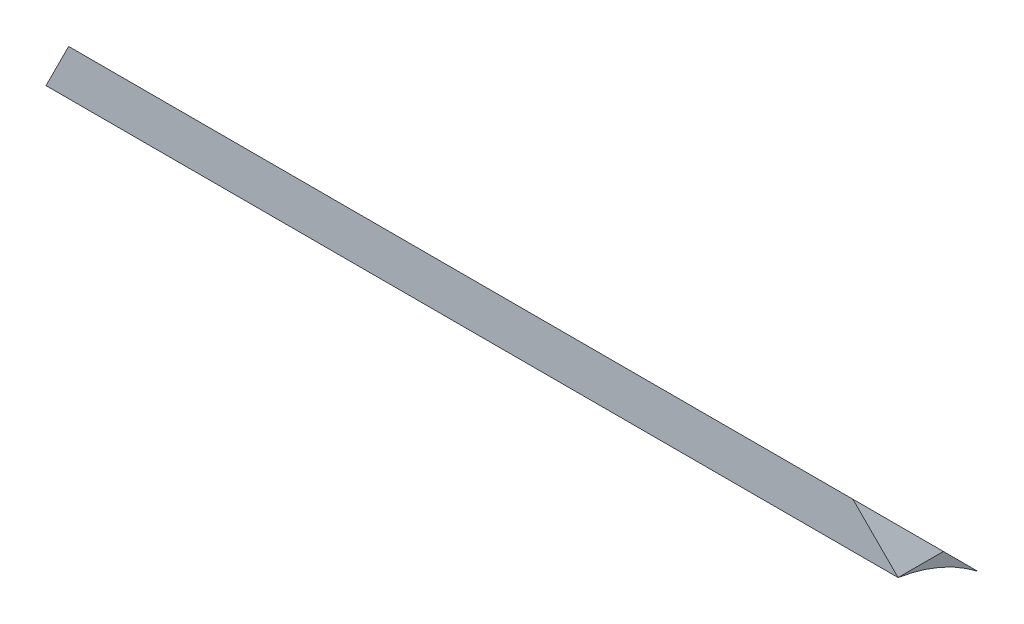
SolidWorks part; units mm, degrees
ref_plane "Front Plane" through (0, 0, 0) normal (0, 0, 1) x (1, 0, 0)
ref_plane "Top Plane" through (0, 0, 0) normal (0, 1, 0) x (1, 0, 0)
ref_plane "Right Plane" through (0, 0, 0) normal (1, 0, 0) x (0, 0, -1)
sketch "Sketch1" plane through (0, 0, 0) normal (0, 1, 0) x (1, 0, 0)
  line L1 (0, 0) -> (101.6, 0)
  line L2 (0, 0) -> (0, 12.7)
  line L3 (0, 12.7) -> (101.6, 12.7)
  line L4 (101.6, 0) -> (101.6, 12.7)
  dimension "D1" = 101.6
  dimension "D2" = 12.7
extrude "Extrude1" add sketch "Sketch1" along normal blind 12.7
sketch "Sketch2" plane through (101.6, 0, 0) normal (1, 0, 0) x (0, 0, -1)
  line L0 (0, 12.7) -> (12.7, 0)
  line L1 (0, 12.7) -> (12.7, 12.7)
  line L2 (12.7, 12.7) -> (12.7, 0)
extrude "Cut-Extrude1" cut sketch "Sketch2" against normal through all
sketch "Sketch3" plane through (101.6, 0, 0) normal (1, 0, 0) x (0, 0, -1)
  line L0 (0, 4.3705) -> (0, 19.3204)
  line L1 (0, 19.3204) -> (3.175, 19.3204)
  line L2 (3.175, 19.3204) -> (3.175, 4.1248)
  arc A0 (0, 4.3705) -> (3.175, 4.1248) centre (0, -16.267) ccw
  dimension "D1" = 20.6375
  dimension "D2" = 3.175
extrude "Cut-Extrude2" cut sketch "Sketch3" against normal through all
sketch "Sketch5" plane through (0, 0, 0) normal (0, 0, 1) x (1, 0, 0)
  line L0 (101.6, 0) -> (101.6, 4.1248)
  line L1 (101.6, 4.1248) -> (50.8, 54.9248)
  line L2 (50.8, 54.9248) -> (25.4, 54.9248)
  line L3 (25.4, 54.9248) -> (0, 4.1248)
  line L4 (0, 0) -> (101.6, 0)
  line L5 (0, 4.1248) -> (0, 0)
  line L6 (0, 4.1248) -> (101.6, 4.1248) construction
  dimension "D1" = 25.4
  dimension "D2" = 50.8
  dimension "D3" = 50.8
extrude "Cut-Extrude6" cut sketch "Sketch5" against normal through all flip side to cut
